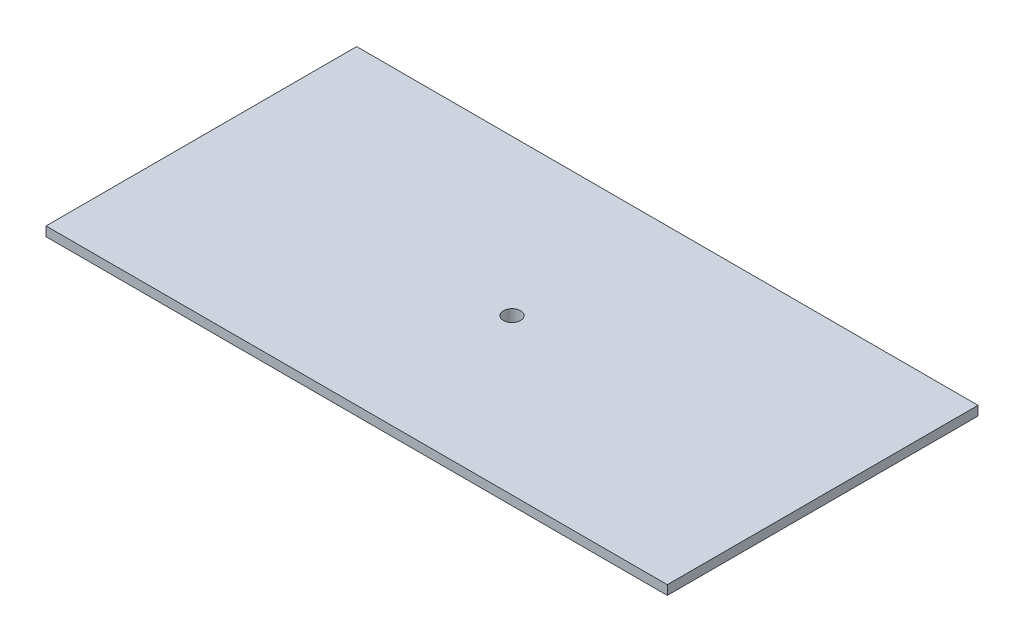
SolidWorks part; units mm, degrees
ref_plane "Front Plane" through (0, 0, 0) normal (0, 0, 1) x (1, 0, 0)
ref_plane "Top Plane" through (0, 0, 0) normal (0, 1, 0) x (1, 0, 0)
ref_plane "Right Plane" through (0, 0, 0) normal (1, 0, 0) x (0, 0, -1)
sketch "Sketch2" plane through (0, 0, 0) normal (0, 1, 0) x (1, 0, 0)
  line L1 (-100, -50) -> (100, -50)
  line L2 (-100, -50) -> (-100, 50)
  line L3 (-100, 50) -> (100, 50)
  line L4 (100, -50) -> (100, 50)
  line L5 (-100, -50) -> (100, 50) construction
  line L6 (-100, 50) -> (100, -50) construction
  point P0 (0, 0)
  dimension "D1" = 200
  dimension "D2" = 100
extrude "Boss-Extrude1" add sketch "Sketch2" along normal blind 3
sketch "Sketch3" plane through (0, 3, 0) normal (0, 1, 0) x (1, 0, 0)
  circle A0 centre (0, 0) radius 2.75
  dimension "D1" = 5.5
extrude "Cut-Extrude1" cut sketch "Sketch3" against normal up to surface (3 mm away)
sketch "Sketch4" plane through (0, 0, 0) normal (0, -1, 0) x (1, 0, 0)
  line L1 (-3.5, -3.5) -> (3.5, -3.5)
  line L2 (-3.5, -3.5) -> (-3.5, 3.5)
  line L3 (-3.5, 3.5) -> (3.5, 3.5)
  line L4 (3.5, -3.5) -> (3.5, 3.5)
  line L5 (-3.5, -3.5) -> (3.5, 3.5) construction
  line L6 (-3.5, 3.5) -> (3.5, -3.5) construction
  circle A0 centre (0, 0) radius 2.75
  circle A1 centre (0, 0) radius 2.75 construction
  dimension "D1" = 7
extrude "Boss-Extrude2" add sketch "Sketch4" along normal blind 6
sketch "Sketch5" plane through (0, 0, 0) normal (0, -1, 0) x (1, 0, 0)
  circle A0 centre (0, 0) radius 5
  circle A1 centre (0, 0) radius 2.75
  circle A2 centre (0, 0) radius 2.75 construction
  dimension "D1" = 10
extrude "Boss-Extrude3" add sketch "Sketch5" along normal blind 1.5
